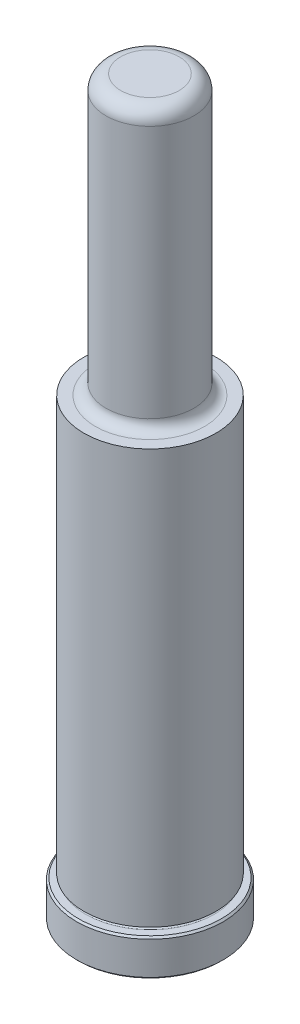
SolidWorks part; units mm, degrees
ref_plane "Front Plane" through (0, 0, 0) normal (0, 0, 1) x (1, 0, 0)
ref_plane "Top Plane" through (0, 0, 0) normal (0, 1, 0) x (1, 0, 0)
ref_plane "Right Plane" through (0, 0, 0) normal (1, 0, 0) x (0, 0, -1)
sketch "Sketch1" plane through (0, 0, 0) normal (1, 0, 0) x (0, 0, -1)
  line L0 (0, 0) -> (15.875, 0)
  line L1 (15.875, 0) -> (15.875, 7.9248)
  line L2 (15.875, 7.9248) -> (13.8938, 7.9248)
  line L3 (13.5128, 2.6782) -> (13.5128, 5.9795) construction
  line L4 (13.8938, 8.6868) -> (14.3002, 8.6868)
  line L5 (14.3002, 8.6868) -> (14.3002, 98.425)
  line L6 (14.3002, 98.425) -> (11.7983, 98.425)
  line L7 (9.5123, 100.711) -> (9.5123, 158.75)
  line L9 (9.5123, 158.75) -> (0, 158.75)
  line L10 (0, 158.75) -> (0, 0)
  line L11 (0, 0) -> (0, -7.2694) construction
  arc A0 (13.8938, 8.6868) -> (13.8938, 7.9248) centre (13.8938, 8.3058) ccw
  arc A1 (11.7983, 98.425) -> (9.5123, 100.711) centre (11.7983, 100.711) cw
  point P2 (9.5123, 158.75)
  point P14 (9.5123, 158.5133)
  point P19 (9.5123, 98.425)
  dimension "D14" = 0.762
  dimension "D8" = 2.286
  dimension "T" = 7.9248
  dimension "D2" = 0.762
  dimension "M" = 31.75
  dimension "B" = 28.6004
  dimension "L" = 158.75
  dimension "D7" = 0.7874
  dimension "A" = 98.425
  dimension "D" = 19.0246
  dimension "D15" = 60.325
revolve "Revolve1" add sketch "Sketch1" angle 360 about L11
chamfer "Chamfer1" distance 0.381 angle 45 2 edges at (0, 0, 15.875) (0, 7.9248, 15.875)
fillet "Fillet7" radius 3.175 1 edges at (0, 158.75, 9.5123)
